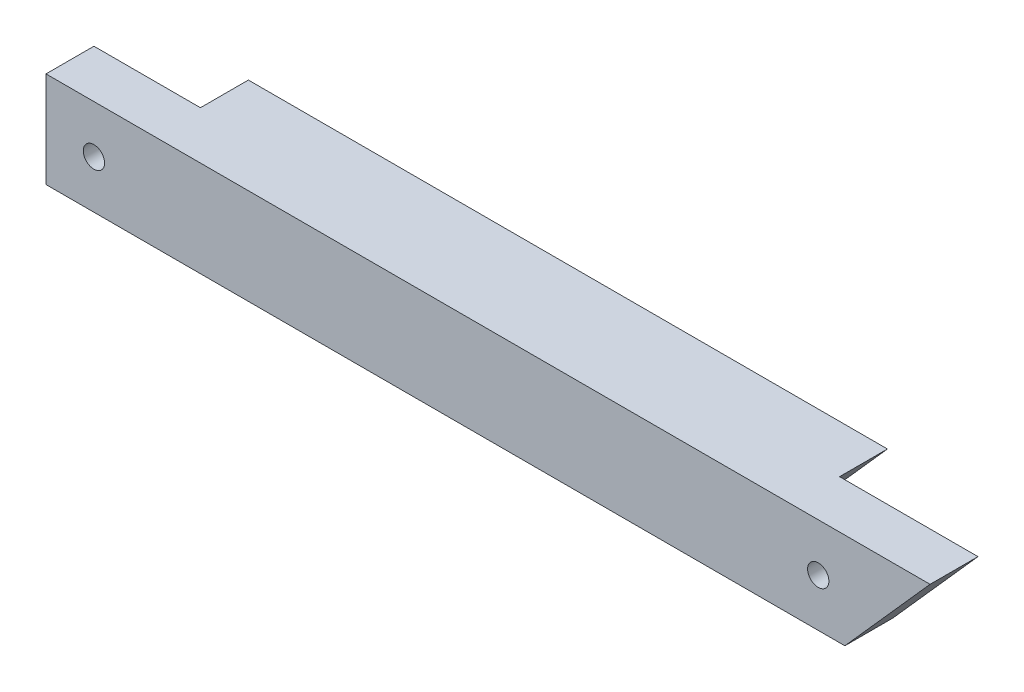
SolidWorks part; units mm, degrees
ref_plane "Plan de face" through (0, 0, 0) normal (0, 0, 1) x (1, 0, 0)
ref_plane "Plan de dessus" through (0, 0, 0) normal (0, 1, 0) x (1, 0, 0)
ref_plane "Plan de droite" through (0, 0, 0) normal (1, 0, 0) x (0, 0, -1)
sketch "Esquisse1" plane through (0, 0, 0) normal (0, 0, 1) x (1, 0, 0)
  line L1 (0, 0) -> (83, 0)
  line L2 (0, 0) -> (0, 9)
  line L3 (0, 9) -> (83, 9)
  line L4 (83, 0) -> (83, 9)
  dimension "D1" = 83
  dimension "D2" = 9
extrude "Extrusion1" add sketch "Esquisse1" along normal blind 9
sketch "Esquisse2" plane through (0, 0, 0) normal (0, 0, -1) x (-1, 0, 0)
  line L0 (-83, 9) -> (0, 9) construction
  line L1 (-10, 9) -> (0, 9)
  line L2 (-10, 9) -> (-10, 0)
  line L3 (-10, 0) -> (0, 0)
  line L4 (0, 9) -> (0, 0)
  dimension "D1" = 10
extrude "Enlèv. mat.-Extru.1" cut sketch "Esquisse2" against normal blind 4.5
sketch "Esquisse3" plane through (0, 0, 4.5) normal (0, 0, -1) x (-1, 0, 0)
  line L0 (0, 0) -> (0, 9) construction
  line L1 (-10, 0) -> (0, 0) construction
  circle A0 centre (-4.5, 4.5) radius 1
  dimension "D3" = 2
  dimension "D1" = 4.5
  dimension "D2" = 4.5
extrude "Enlèv. mat.-Extru.2" cut sketch "Esquisse3" against normal blind 4.5
sketch "Esquisse4" plane through (0, 0, 0) normal (0, 0, -1) x (-1, 0, 0)
  line L0 (-83, 0) -> (-75, 0)
  line L1 (-10, 0) -> (-83, 0) construction
  line L2 (-75, 0) -> (-83, 9)
  line L3 (-83, 9) -> (-83, 0)
  dimension "D1" = 8
extrude "Enlèv. mat.-Extru.3" cut sketch "Esquisse4" against normal blind 9
sketch "Esquisse5" plane through (0, 0, 0) normal (0, 0, -1) x (-1, 0, 0)
  line L0 (-83, 9) -> (-70, 9)
  line L1 (-83, 9) -> (-10, 9) construction
  line L2 (-70, 9) -> (-62, 0)
  line L3 (-10, 0) -> (-75, 0) construction
  line L4 (-62, 0) -> (-75, 0)
  line L5 (-75, 0) -> (-83, 9)
  dimension "D1" = 13
  dimension "D2" = 13
extrude "Enlèv. mat.-Extru.4" cut sketch "Esquisse5" against normal blind 4.5
sketch "Esquisse6" plane through (0, 0, 4.5) normal (0, 0, -1) x (-1, 0, 0)
  line L0 (-75, 0) -> (-62, 0) construction
  circle A0 centre (-72.5, 4.5) radius 1
  dimension "D3" = 2
  dimension "D1" = 10.5
  dimension "D2" = 4.5
extrude "Enlèv. mat.-Extru.5" cut sketch "Esquisse6" against normal blind 4.5
